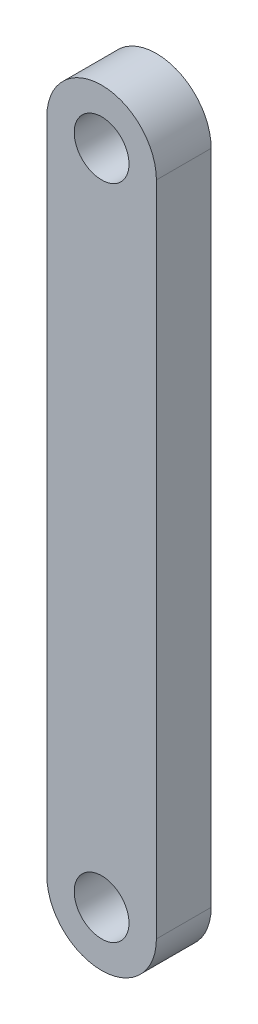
SolidWorks part; units mm, degrees
ref_plane "Front Plane" through (0, 0, 0) normal (0, 0, 1) x (1, 0, 0)
ref_plane "Top Plane" through (0, 0, 0) normal (0, 1, 0) x (1, 0, 0)
ref_plane "Right Plane" through (0, 0, 0) normal (1, 0, 0) x (0, 0, -1)
sketch "Sketch1" plane through (0, 0, 0) normal (0, 0, 1) x (1, 0, 0)
  line L2 (-10, 60) -> (-10, -60)
  line L4 (10, 60) -> (10, -60)
  line L5 (-10, 60) -> (10, -60) construction
  line L6 (-10, -60) -> (10, 60) construction
  arc A0 (10, 60) -> (-10, 60) centre (0, 60) ccw
  arc A1 (-10, -60) -> (10, -60) centre (0, -60) ccw
  point P0 (0, 0)
  dimension "D1" = 120
  dimension "D2" = 20
extrude "Boss-Extrude1" add sketch "Sketch1" along normal blind 10
sketch "Sketch2" plane through (0, 0, 0) normal (0, 0, 1) x (1, 0, 0)
  line L0 (-10, 60) -> (10, 60) construction
  line L1 (-10, -60) -> (10, -60) construction
  arc A0 (10, 60) -> (-10, 60) centre (0, 60) ccw construction
  circle A1 centre (0, 60) radius 5
  circle A2 centre (0, -60) radius 5
  dimension "D1" = 10
  dimension "D2" = 10
extrude "Cut-Extrude1" cut sketch "Sketch2" along normal blind 10
